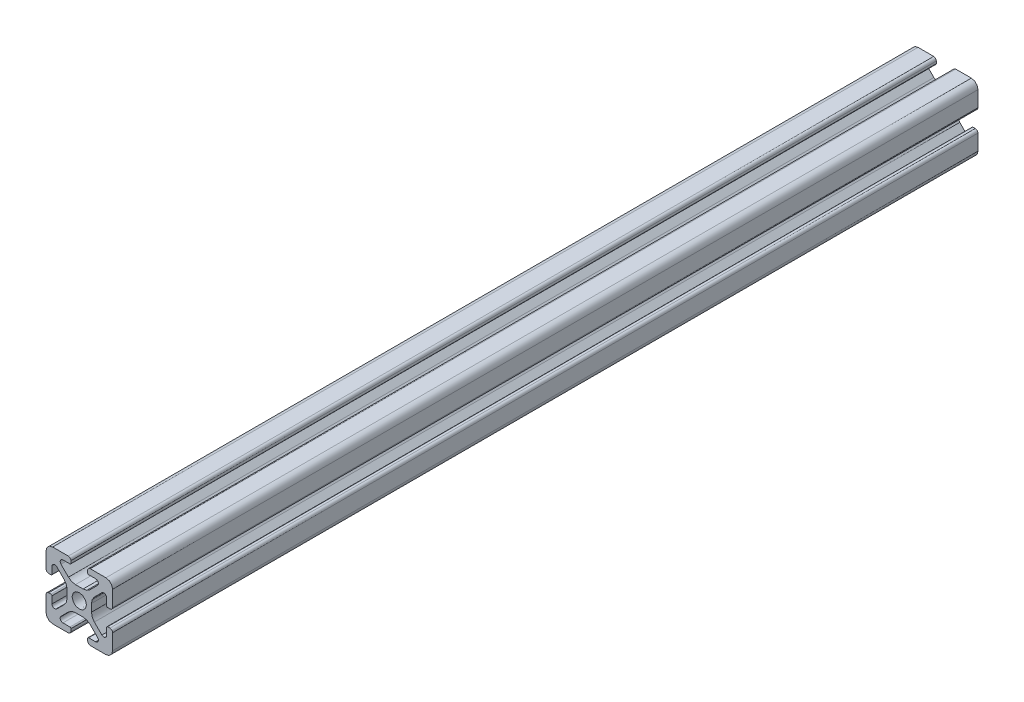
SolidWorks part; units mm, degrees
ref_plane "Aufriss" through (0, 0, 0) normal (0, 0, 1) x (1, 0, 0)
ref_plane "Grundriss" through (0, 0, 0) normal (0, 1, 0) x (1, 0, 0)
ref_plane "Seitenriss" through (0, 0, 0) normal (1, 0, 0) x (0, 0, -1)
sketch "Skizze2" plane through (0, 0, 0) normal (0, 0, 1) x (1, 0, 0)
  line L72 (2.5, -8.5) -> (2.5, -9.2)
  line L73 (3.3, -10) -> (8, -10)
  line L74 (10, -8) -> (10, -3.3)
  line L75 (9.2, -2.5) -> (8.5, -2.5)
  line L76 (8.2, -2.8) -> (8.2, -4.9176)
  line L77 (6.779, -5.5062) -> (4.5287, -3.2559)
  line L78 (3.65, -1.1346) -> (3.65, 1.1346)
  line L79 (4.5287, 3.2559) -> (6.779, 5.5062)
  line L80 (8.2, 4.9176) -> (8.2, 2.8)
  line L81 (8.5, 2.5) -> (9.2, 2.5)
  line L82 (10, 3.3) -> (10, 8)
  line L83 (8, 10) -> (3.3, 10)
  line L84 (2.5, 9.2) -> (2.5, 8.5)
  line L85 (2.8, 8.2) -> (4.9176, 8.2)
  line L86 (5.5062, 6.779) -> (3.2559, 4.5287)
  line L87 (1.1346, 3.65) -> (-1.1346, 3.65)
  line L88 (-3.2559, 4.5287) -> (-5.5062, 6.779)
  line L89 (-4.9176, 8.2) -> (-2.8, 8.2)
  line L90 (-2.5, 8.5) -> (-2.5, 9.2)
  line L91 (-3.3, 10) -> (-8, 10)
  line L92 (-10, 8) -> (-10, 3.3)
  line L93 (-9.2, 2.5) -> (-8.5, 2.5)
  line L94 (-8.2, 2.8) -> (-8.2, 4.9176)
  line L95 (-6.779, 5.5062) -> (-4.5287, 3.2559)
  line L96 (-3.65, 1.1346) -> (-3.65, -1.1346)
  line L97 (-4.5287, -3.2559) -> (-6.779, -5.5062)
  line L98 (-8.2, -4.9176) -> (-8.2, -2.8)
  line L99 (-8.5, -2.5) -> (-9.2, -2.5)
  line L100 (-10, -3.3) -> (-10, -8)
  line L101 (-8, -10) -> (-3.3, -10)
  line L102 (-2.5, -9.2) -> (-2.5, -8.5)
  line L103 (-2.8, -8.2) -> (-4.9176, -8.2)
  line L104 (-5.5062, -6.779) -> (-3.2559, -4.5287)
  line L105 (-1.1346, -3.65) -> (1.1346, -3.65)
  line L106 (3.2559, -4.5287) -> (5.5062, -6.779)
  line L107 (4.9176, -8.2) -> (2.8, -8.2)
  circle A1 centre (0, 0) radius 2.15
  arc A72 (2.8, -8.2) -> (2.5, -8.5) centre (2.8, -8.5) ccw
  arc A73 (2.5, -9.2) -> (3.3, -10) centre (3.3, -9.2) ccw
  arc A74 (8, -10) -> (10, -8) centre (8, -8) ccw
  arc A75 (10, -3.3) -> (9.2, -2.5) centre (9.2, -3.3) ccw
  arc A76 (8.5, -2.5) -> (8.2, -2.8) centre (8.5, -2.8) ccw
  arc A77 (6.779, -5.5062) -> (8.2, -4.9176) centre (7.3676, -4.9176) ccw
  arc A78 (3.65, -1.1346) -> (4.5287, -3.2559) centre (6.65, -1.1346) ccw
  arc A79 (4.5287, 3.2559) -> (3.65, 1.1346) centre (6.65, 1.1346) ccw
  arc A80 (8.2, 4.9176) -> (6.779, 5.5062) centre (7.3676, 4.9176) ccw
  arc A81 (8.2, 2.8) -> (8.5, 2.5) centre (8.5, 2.8) ccw
  arc A82 (9.2, 2.5) -> (10, 3.3) centre (9.2, 3.3) ccw
  arc A83 (10, 8) -> (8, 10) centre (8, 8) ccw
  arc A84 (3.3, 10) -> (2.5, 9.2) centre (3.3, 9.2) ccw
  arc A85 (2.5, 8.5) -> (2.8, 8.2) centre (2.8, 8.5) ccw
  arc A86 (5.5062, 6.779) -> (4.9176, 8.2) centre (4.9176, 7.3676) ccw
  arc A87 (1.1346, 3.65) -> (3.2559, 4.5287) centre (1.1346, 6.65) ccw
  arc A88 (-3.2559, 4.5287) -> (-1.1346, 3.65) centre (-1.1346, 6.65) ccw
  arc A89 (-4.9176, 8.2) -> (-5.5062, 6.779) centre (-4.9176, 7.3676) ccw
  arc A90 (-2.8, 8.2) -> (-2.5, 8.5) centre (-2.8, 8.5) ccw
  arc A91 (-2.5, 9.2) -> (-3.3, 10) centre (-3.3, 9.2) ccw
  arc A92 (-8, 10) -> (-10, 8) centre (-8, 8) ccw
  arc A93 (-10, 3.3) -> (-9.2, 2.5) centre (-9.2, 3.3) ccw
  arc A94 (-8.5, 2.5) -> (-8.2, 2.8) centre (-8.5, 2.8) ccw
  arc A95 (-6.779, 5.5062) -> (-8.2, 4.9176) centre (-7.3676, 4.9176) ccw
  arc A96 (-3.65, 1.1346) -> (-4.5287, 3.2559) centre (-6.65, 1.1346) ccw
  arc A97 (-4.5287, -3.2559) -> (-3.65, -1.1346) centre (-6.65, -1.1346) ccw
  arc A98 (-8.2, -4.9176) -> (-6.779, -5.5062) centre (-7.3676, -4.9176) ccw
  arc A99 (-8.2, -2.8) -> (-8.5, -2.5) centre (-8.5, -2.8) ccw
  arc A100 (-9.2, -2.5) -> (-10, -3.3) centre (-9.2, -3.3) ccw
  arc A101 (-10, -8) -> (-8, -10) centre (-8, -8) ccw
  arc A102 (-3.3, -10) -> (-2.5, -9.2) centre (-3.3, -9.2) ccw
  arc A103 (-2.5, -8.5) -> (-2.8, -8.2) centre (-2.8, -8.5) ccw
  arc A104 (-5.5062, -6.779) -> (-4.9176, -8.2) centre (-4.9176, -7.3676) ccw
  arc A105 (-1.1346, -3.65) -> (-3.2559, -4.5287) centre (-1.1346, -6.65) ccw
  arc A106 (3.2559, -4.5287) -> (1.1346, -3.65) centre (1.1346, -6.65) ccw
  arc A107 (4.9176, -8.2) -> (5.5062, -6.779) centre (4.9176, -7.3676) ccw
extrude "Linear austragen2" add sketch "Skizze2" against normal blind 300
other "Einfrieren***"
